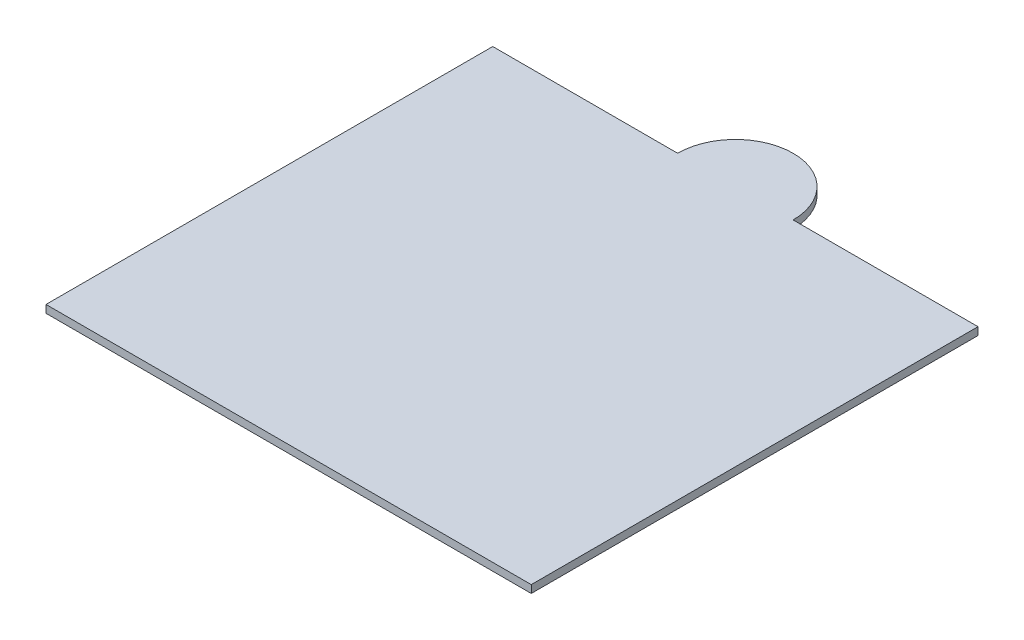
SolidWorks part; units mm, degrees
ref_plane "Front Plane" through (0, 0, 0) normal (0, 0, 1) x (1, 0, 0)
ref_plane "Top Plane" through (0, 0, 0) normal (0, 1, 0) x (1, 0, 0)
ref_plane "Right Plane" through (0, 0, 0) normal (1, 0, 0) x (0, 0, -1)
sketch "Sketch1" plane through (0, 0, 0) normal (0, 1, 0) x (1, 0, 0)
  line L1 (31.5, -29) -> (-31.5, -29)
  line L2 (31.5, -29) -> (31.5, 29)
  line L3 (31.5, 29) -> (-31.5, 29)
  line L4 (-31.5, -29) -> (-31.5, 29)
  line L5 (31.5, -29) -> (-31.5, 29) construction
  line L6 (31.5, 29) -> (-31.5, -29) construction
  arc A0 (-7.5, 29) -> (7.5, 29) centre (0, 29) cw
  point P0 (0, 0)
  point P9 (0, 29)
  dimension "D3" = 7.5
  dimension "D1" = 58
  dimension "D2" = 63
extrude "Boss-Extrude1" add sketch "Sketch1" along normal blind 1 contours A0 L3
